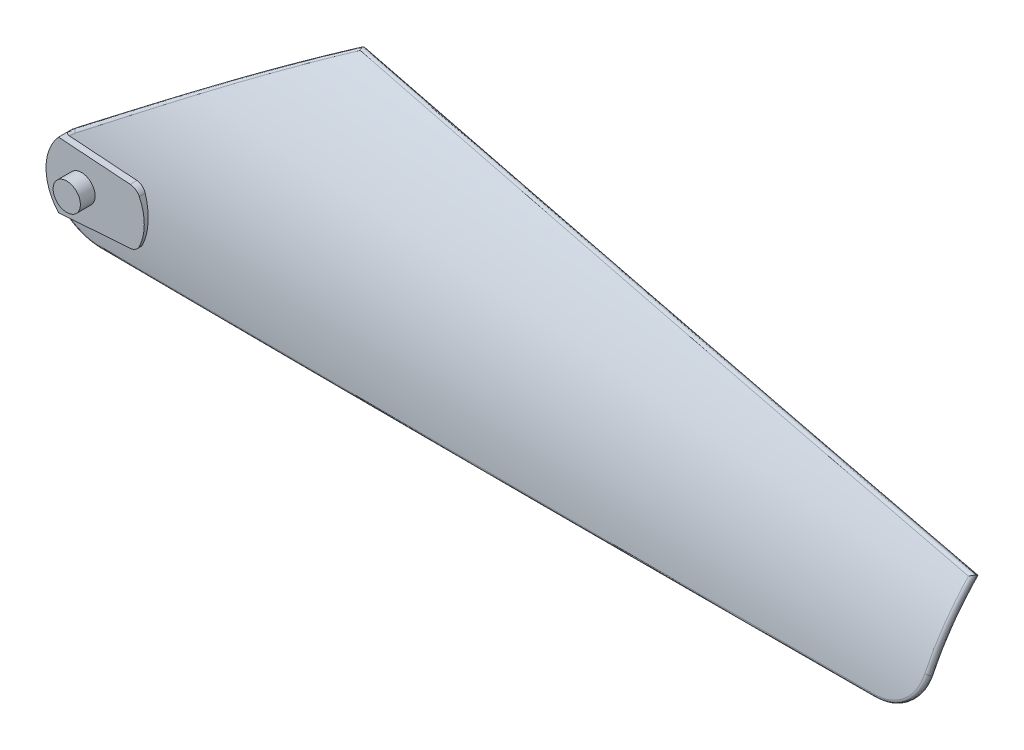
SolidWorks part; units mm, degrees
ref_plane "Plan de face" through (0, 0, 0) normal (0, 0, 1) x (1, 0, 0)
ref_plane "Plan de dessus" through (0, 0, 0) normal (0, 1, 0) x (1, 0, 0)
ref_plane "Plan de droite" through (0, 0, 0) normal (1, 0, 0) x (0, 0, -1)
mirrored part "pale_Symétrique"
other "<PALE>-<Congé1>"
other "<PALE>-<Congé2>"
